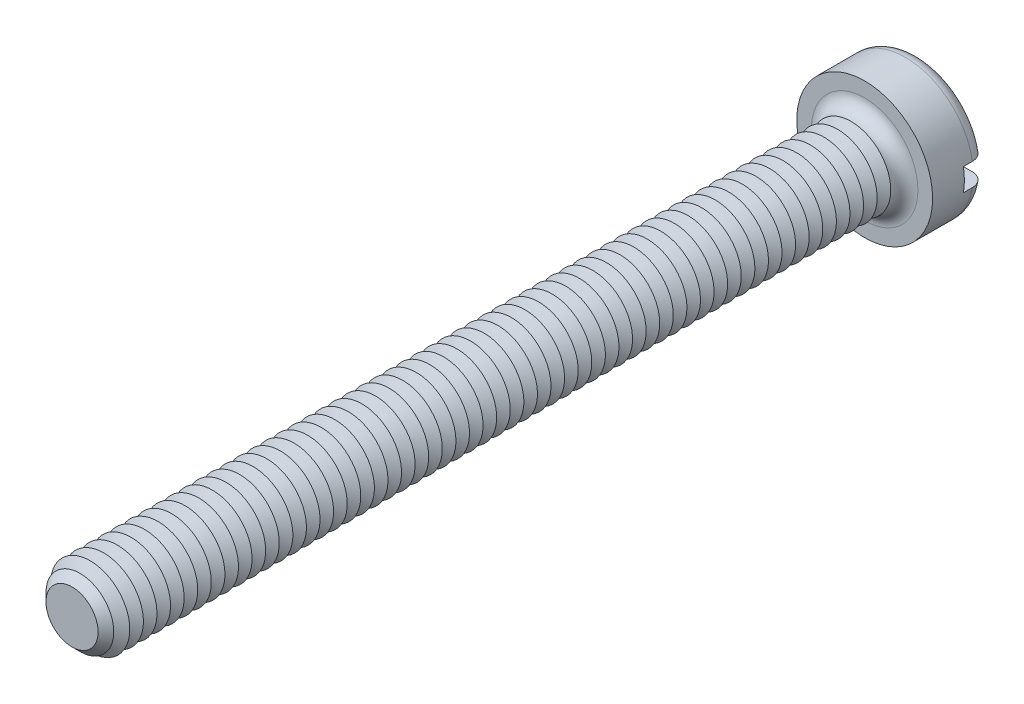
SolidWorks part; units mm, degrees
ref_plane "Front Plane" through (0, 0, 0) normal (0, 0, 1) x (1, 0, 0)
ref_plane "Top Plane" through (0, 0, 0) normal (0, 1, 0) x (1, 0, 0)
ref_plane "Right Plane" through (0, 0, 0) normal (1, 0, 0) x (0, 0, -1)
sketch "Sketch3" plane through (0, 0, 0) normal (0, 0, 1) x (1, 0, 0)
  circle A0 centre (0, 0) radius 3
  dimension "D1" = 6
extrude "Boss-Extrude2" add sketch "Sketch3" against normal blind 2.4
sketch "Sketch4" plane through (0, 0, 0) normal (0, 0, 1) x (1, 0, 0)
  circle A0 centre (0, 0) radius 1.75
  dimension "D1" = 3.5
extrude "Boss-Extrude3" add sketch "Sketch4" along normal blind 35
fillet "Fillet1" radius 0.6 2 edges at (3, 0, -2.4) (1.75, 0, 0)
chamfer "Chamfer1" distance 0.6 angle 45 1 edges at (1.75, 0, 35)
sketch "Sketch5" plane through (0, 0, 0) normal (1, 0, 0) x (0, 0, -1)
  line L0 (1.6944, 0) -> (-7.6738, 0) construction
sketch "Sketch6" plane through (0, 0, 0) normal (1, 0, 0) x (0, 0, -1)
  line L0 (-0.6, 1.75) -> (-0.9, 1.2304)
  line L1 (-0.9, 1.2304) -> (-1.2, 1.75)
  line L2 (-0.6, 1.75) -> (-34.4, 1.75) construction
  line L3 (-1.2, 1.75) -> (-0.6, 1.75)
  dimension "D1" = 0.6
revolve "Cut-Revolve1" cut sketch "Sketch6" angle 360 about L0
pattern_linear "LPattern1" count 57 spacing 0.6 along (0, 0, 1) of "Cut-Revolve1"
sketch "Sketch8" plane through (0, 0, -2.4) normal (0, 0, -1) x (-1, 0, 0)
  line L1 (3, -0.5) -> (-3, -0.5)
  line L2 (3, -0.5) -> (3, 0.5)
  line L3 (3, 0.5) -> (-3, 0.5)
  line L4 (-3, -0.5) -> (-3, 0.5)
  line L5 (3, -0.5) -> (-3, 0.5) construction
  line L6 (3, 0.5) -> (-3, -0.5) construction
  point P0 (0, 0)
  dimension "D1" = 6
  dimension "D2" = 1
extrude "Cut-Extrude1" cut sketch "Sketch8" against normal blind 1
